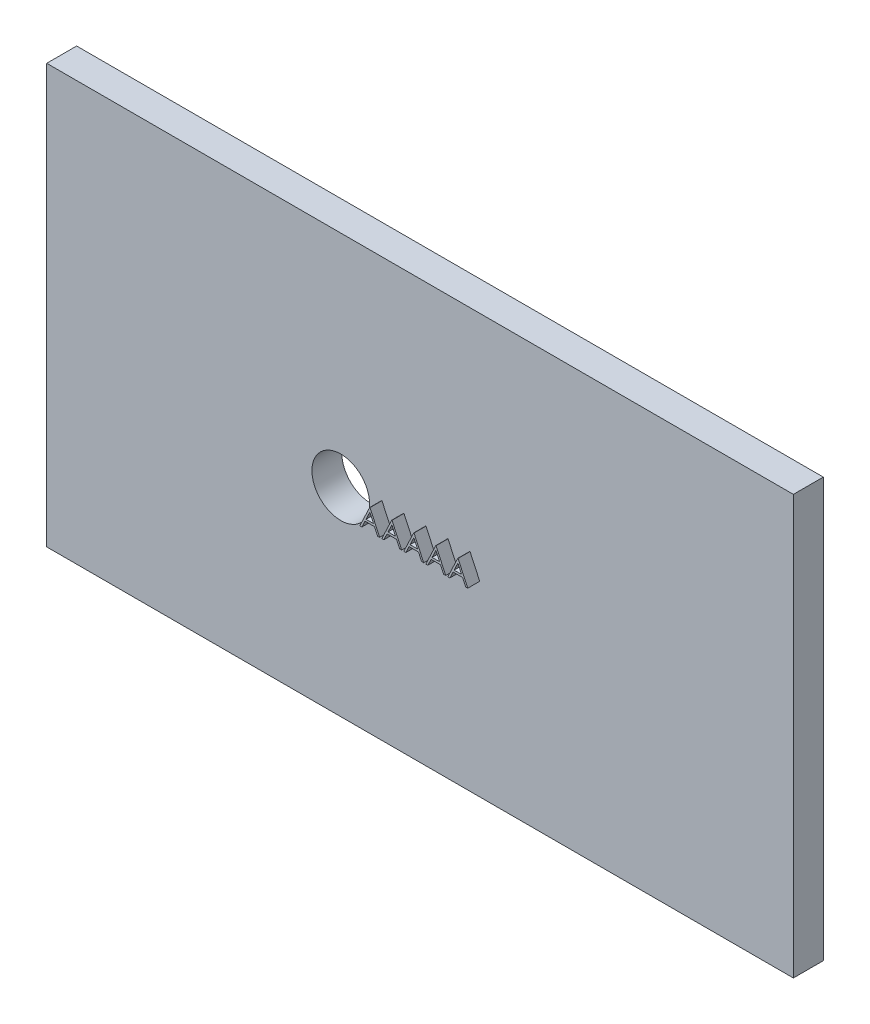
SolidWorks part; units mm, degrees
ref_plane "Ebene vorne" through (0, 0, 0) normal (0, 0, 1) x (1, 0, 0)
ref_plane "Ebene oben" through (0, 0, 0) normal (0, 1, 0) x (1, 0, 0)
ref_plane "Ebene rechts" through (0, 0, 0) normal (1, 0, 0) x (0, 0, -1)
sketch "Skizze1" plane through (0, 0, 0) normal (0, 0, 1) x (1, 0, 0)
  line L1 (0, 0) -> (124.7448, 0)
  line L2 (0, 0) -> (0, 69.9788)
  line L3 (0, 69.9788) -> (124.7448, 69.9788)
  line L4 (124.7448, 0) -> (124.7448, 69.9788)
  circle A0 centre (49.1245, 33.1968) radius 4.8149
extrude "Linear austragen1" add sketch "Skizze1" along normal blind 5
sketch "Skizze3" plane through (0, 0, 5) normal (0, 0, 1) x (1, 0, 0)
  line L0 (49.1245, 33.1968) -> (99.3299, 33.1968) construction
  line L1 (49.1245, 31.1968) -> (99.9463, 31.1968) construction
  point P5 (54.1245, 31.1968)
  dimension "D1" = 2
  dimension "D2" = 5
sketch "Skizze2" plane through (0, 0, 5) normal (0, 0, 1) x (1, 0, 0)
  text T0 "AAAAA"
extrude "Linear austragen2" add sketch "Skizze2" along normal blind 2
equation "\"LÄNGE\"=0"
equation "\"BREITE\"=0"
equation "\"HÖHE\"=0"
equation "\"DURCHMESSER\"=0"
equation "\"Stückzahl\"= 1"
